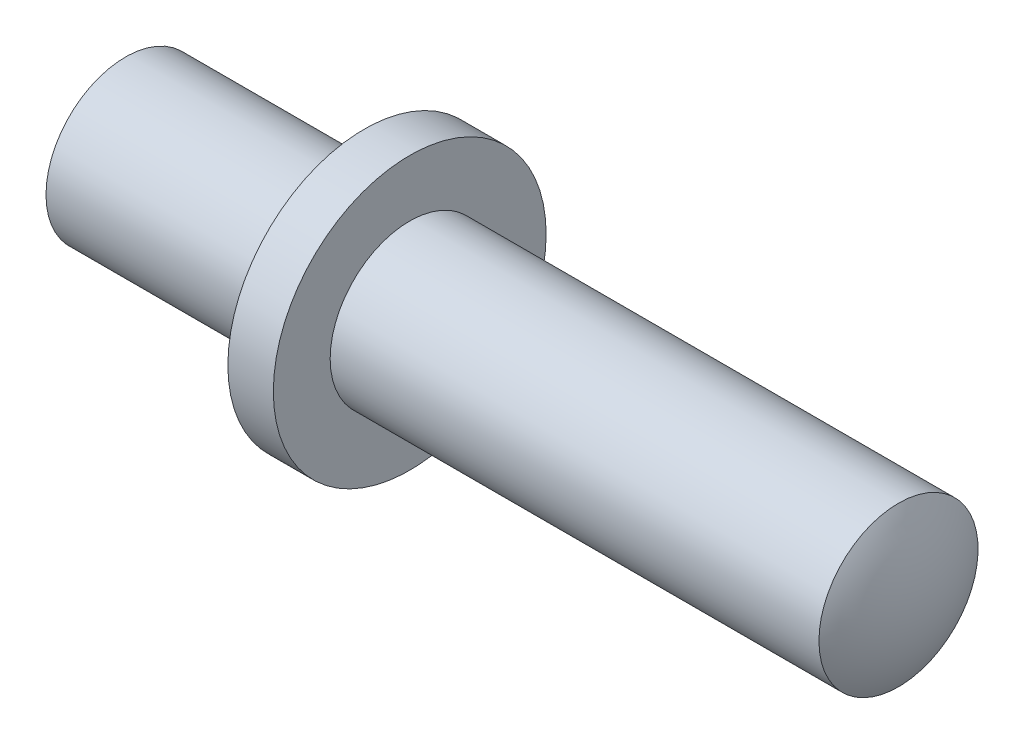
SolidWorks part; units mm, degrees
ref_plane "Face" through (0, 0, 0) normal (0, 0, 1) x (1, 0, 0)
ref_plane "Dessus" through (0, 0, 0) normal (0, 1, 0) x (1, 0, 0)
ref_plane "Droite" through (0, 0, 0) normal (1, 0, 0) x (0, 0, -1)
sketch "Esquisse1" plane through (0, 0, 0) normal (0, 0, 1) x (1, 0, 0)
  line L0 (0, 0) -> (82.4263, 0) construction
  line L1 (10.0561, 0) -> (10.0561, 7)
  line L2 (10.0561, 7) -> (31.0561, 7)
  line L3 (31.0561, 7) -> (31.0561, 12)
  line L4 (31.0561, 12) -> (35.0561, 12)
  line L5 (35.0561, 12) -> (35.0561, 7)
  line L6 (35.0561, 7) -> (78.0561, 7)
  line L7 (10.0561, 0) -> (80.0386, 0)
  arc A0 (80.0386, 0) -> (78.0561, 7) centre (66.6893, 0) ccw
  dimension "D1" = 14
  dimension "D2" = 21
  dimension "D3" = 4
  dimension "D4" = 24
  dimension "D5" = 43
revolve "Révolution1" add sketch "Esquisse1" angle 360 about L0
